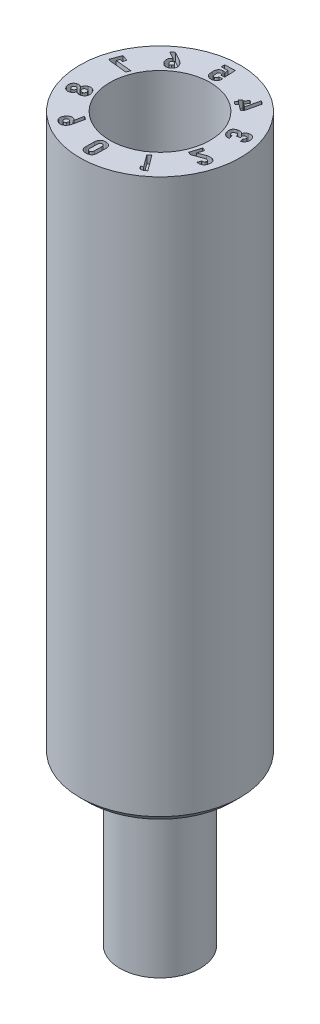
SolidWorks part; units mm, degrees
other "<M2L6-SetScrew>-<Chamfer1>" parameters "D10"=0.19
ref_plane "Front Plane" through (0, 0, 0) normal (0, 0, 1) x (1, 0, 0)
ref_plane "Top Plane" through (0, 0, 0) normal (0, 1, 0) x (1, 0, 0)
ref_plane "Right Plane" through (0, 0, 0) normal (1, 0, 0) x (0, 0, -1)
sketch "Sketch1" plane through (0, 0, 0) normal (0, 0, 1) x (1, 0, 0)
  line L0 (0, 0) -> (0, 20) construction
  line L1 (0, -55) -> (0, 55) construction
  line L2 (1, -14) -> (1.81, -14)
  line L4 (2, -13.81) -> (2, 0)
  line L5 (2, 0) -> (1.25, 0)
  line L6 (1.25, 0) -> (1.25, -2.3)
  line L7 (1.25, -2.3) -> (0.7, -2.3)
  line L8 (0.7, -2.3) -> (0.7, -10.5)
  line L9 (0.7, -10.5) -> (1, -10.5)
  line L10 (1, -10.5) -> (1, -14)
  line L11 (1.81, -14) -> (2, -13.81)
  point P6 (2, -14)
  dimension "D1" = 2.3
  dimension "D2" = 3.5
  dimension "D3" = 1.4
  dimension "D4" = 2.5
  dimension "D5" = 4
  dimension "D6" = 2
  dimension "D7" = 14
revolve "Revolve1" add sketch "Sketch1" angle 360 about L0
sketch "Sketch2" plane through (0, 0, 0) normal (0, 1, 0) x (1, 0, 0)
  line L0 (0, 0) -> (0, 2.1482) construction
  line L1 (0, 0) -> (1.2627, 1.738) construction
  line L2 (0, 0) -> (2.0431, 0.6638) construction
  line L3 (0, 0) -> (2.0431, -0.6638) construction
  line L4 (0, 0) -> (1.2627, -1.738) construction
  line L5 (0, 0) -> (0, -2.1482) construction
  line L6 (0, 0) -> (-1.2627, -1.738) construction
  line L7 (0, 0) -> (-2.0431, -0.6638) construction
  line L8 (0, 0) -> (-2.0431, 0.6638) construction
  line L9 (0, 0) -> (-1.2627, 1.738) construction
  line L10 (1.4479, 0.2841) -> (1.4204, 0.3732)
  line L11 (1.3976, 0.475) -> (1.4083, 0.4783)
  line L12 (1.4758, 0.4533) -> (1.4877, 0.4146)
  line L13 (1.4877, 0.4146) -> (1.5707, 0.4402)
  line L14 (1.5707, 0.4402) -> (1.5588, 0.479)
  line L15 (1.5955, 0.5278) -> (1.6034, 0.5303)
  line L16 (1.6228, 0.4435) -> (1.6502, 0.3548)
  line L17 (1.5836, 0.6255) -> (1.5698, 0.6212)
  line L18 (1.3732, 0.5689) -> (1.3593, 0.5647)
  line L19 (1.0367, 1.0854) -> (1.1167, 1.4309)
  line L20 (1.1167, 1.4309) -> (1.0358, 1.4934)
  line L21 (1.0358, 1.4934) -> (0.955, 1.1535)
  line L22 (0.955, 1.1535) -> (0.8859, 1.2068)
  line L23 (0.7846, 1.285) -> (0.7314, 1.2159)
  line L24 (0.7314, 1.2159) -> (0.7611, 1.193)
  line L25 (0.9859, 1.0195) -> (1.0367, 1.0854)
  line L26 (0.96, 1.3028) -> (0.8884, 1.358)
  line L27 (0.8884, 1.358) -> (0.8143, 1.262)
  line L28 (0.716, 1.1345) -> (0.7875, 1.0793)
  line L29 (0.7875, 1.0793) -> (0.8326, 1.1378)
  line L30 (0.0809, 1.4808) -> (0.0808, 1.4811)
  line L31 (0.0808, 1.4811) -> (-0.0096, 1.4773)
  line L32 (-0.0096, 1.4773) -> (-0.0096, 1.4771)
  line L33 (-0.1111, 1.4766) -> (-0.1127, 1.5168)
  line L34 (-0.0169, 1.5422) -> (0.0676, 1.5456)
  line L35 (0.0676, 1.5456) -> (0.0564, 1.8216)
  line L36 (0.0564, 1.8216) -> (-0.2014, 1.8111)
  line L37 (-0.2014, 1.8111) -> (-0.1979, 1.7239)
  line L38 (-0.1979, 1.7239) -> (-0.0305, 1.7307)
  line L39 (-0.0305, 1.7307) -> (-0.027, 1.6459)
  line L40 (-0.2031, 1.5131) -> (-0.2014, 1.4729)
  line L41 (-0.7763, 1.268) -> (-0.7764, 1.2683)
  line L42 (-0.8824, 1.3564) -> (-1.0842, 1.4662)
  line L43 (-1.0842, 1.4662) -> (-1.1671, 1.4055)
  line L44 (-1.1671, 1.4055) -> (-0.9736, 1.3024)
  line L46 (-1.0054, 1.1028) -> (-1.0051, 1.1026)
  line L47 (-0.9283, 1.1518) -> (-0.9285, 1.152)
  line L48 (-0.8472, 1.2111) -> (-0.8471, 1.2109)
  line L49 (-1.7044, 0.4666) -> (-1.2744, 0.4221)
  line L50 (-1.2744, 0.4221) -> (-1.2404, 0.5138)
  line L51 (-1.2404, 0.5138) -> (-1.6439, 0.5521)
  line L52 (-1.6439, 0.5521) -> (-1.6153, 0.6293)
  line L53 (-1.6153, 0.6293) -> (-1.5477, 0.6043)
  line L54 (-1.5477, 0.6043) -> (-1.5165, 0.6889)
  line L55 (-1.5165, 0.6889) -> (-1.6657, 0.744)
  line L56 (-1.6657, 0.744) -> (-1.7605, 0.4874)
  line L57 (-1.7605, 0.4874) -> (-1.7044, 0.4666)
  line L58 (-1.4291, -0.351) -> (-1.4365, -0.3538)
  line L59 (-1.629, -0.4367) -> (-1.6407, -0.4411)
  line L60 (-1.5409, -0.7068) -> (-1.5292, -0.7024)
  line L61 (-1.3298, -0.6378) -> (-1.3224, -0.635)
  line L62 (-1.3664, -0.5552) -> (-1.3707, -0.5569)
  line L63 (-1.4138, -0.4416) -> (-1.4092, -0.4398)
  line L64 (-1.5576, -0.6166) -> (-1.5619, -0.6182)
  line L65 (-1.5979, -0.5214) -> (-1.5932, -0.5196)
  line L67 (-1.0829, -1.2873) -> (-1.0831, -1.2876)
  line L68 (-0.8502, -1.446) -> (-0.8501, -1.4459)
  line L69 (-0.8037, -1.319) -> (-0.7576, -1.1005)
  line L70 (-0.7576, -1.1005) -> (-0.8365, -1.046)
  line L71 (-0.8365, -1.046) -> (-0.8784, -1.2623)
  line L72 (-0.9271, -1.3978) -> (-0.9273, -1.3982)
  line L73 (-1.0097, -1.3409) -> (-1.0095, -1.3406)
  line L74 (-0.1607, -1.4672) -> (-0.1651, -1.6853)
  line L75 (0.122, -1.6911) -> (0.1264, -1.4729)
  line L76 (0.0355, -1.4943) -> (0.032, -1.6662)
  line L77 (-0.0742, -1.6641) -> (-0.0707, -1.4921)
  line L78 (0.8456, -1.048) -> (0.7727, -1.1016)
  line L79 (0.7727, -1.1016) -> (0.9946, -1.4028)
  line L80 (0.9946, -1.4028) -> (0.9342, -1.4196)
  line L81 (0.9342, -1.4196) -> (0.9913, -1.4971)
  line L82 (0.9913, -1.4971) -> (1.0682, -1.4807)
  line L83 (1.0682, -1.4807) -> (1.1305, -1.4348)
  line L84 (1.1305, -1.4348) -> (0.8456, -1.048)
  line L85 (1.3151, -0.5535) -> (1.5704, -0.4606)
  line L86 (1.6329, -0.4556) -> (1.6336, -0.4558)
  line L87 (1.5885, -0.5477) -> (1.5882, -0.5476)
  line L88 (1.5882, -0.5476) -> (1.5607, -0.6361)
  line L89 (1.5607, -0.6361) -> (1.561, -0.6361)
  line L90 (1.6637, -0.3678) -> (1.6634, -0.3677)
  line L91 (1.5332, -0.3725) -> (1.356, -0.441)
  line L92 (1.356, -0.441) -> (1.4045, -0.2845)
  line L93 (1.4045, -0.2845) -> (1.3214, -0.2587)
  line L94 (1.3214, -0.2587) -> (1.2373, -0.5294)
  line L95 (1.2373, -0.5294) -> (1.3151, -0.5535)
  line L96 (0.8143, 1.262) -> (0.7846, 1.285)
  line L97 (0.8859, 1.2068) -> (0.96, 1.3028)
  line L98 (0.7611, 1.193) -> (0.716, 1.1345)
  line L99 (0.8326, 1.1378) -> (0.9859, 1.0195)
  circle A0 centre (0, 0) radius 1.35 construction
  spline S0 degree 3 poles (1.2746, 0.3913) (1.2786, 0.3781) (1.2864, 0.3593) (1.3002, 0.3366) (1.3121, 0.3218) (1.3252, 0.309) (1.3398, 0.2983) (1.3555, 0.2897) (1.3724, 0.2835) (1.3902, 0.2796) (1.4157, 0.278) (1.4351, 0.2809) (1.4479, 0.2841) knots 0 0 0 0 0.181683 0.266779 0.349462 0.430127 0.508479 0.586246 0.664753 0.744624 0.826298 1 1 1 1
  spline S1 degree 3 poles (1.4204, 0.3732) (1.4158, 0.3725) (1.4089, 0.3717) (1.4, 0.3727) (1.3937, 0.374) (1.388, 0.376) (1.3827, 0.3787) (1.3778, 0.382) (1.3735, 0.386) (1.3695, 0.3905) (1.3651, 0.3976) (1.3623, 0.4034) (1.3612, 0.4077) knots 0 0 0 0 0.185457 0.27165 0.355725 0.436094 0.513024 0.590764 0.667857 0.745908 0.82735 1 1 1 1
  spline S2 degree 3 poles (1.3612, 0.4077) (1.359, 0.415) (1.3568, 0.4262) (1.3591, 0.4406) (1.3628, 0.45) (1.3687, 0.4583) (1.3797, 0.4681) (1.3902, 0.4727) (1.3976, 0.475) knots 0 0 0 0 0.265932 0.383608 0.497715 0.612962 0.730917 1 1 1 1
  spline S3 degree 3 poles (1.4083, 0.4783) (1.4161, 0.4806) (1.4276, 0.4833) (1.4425, 0.4827) (1.4519, 0.4804) (1.4602, 0.4763) (1.4696, 0.468) (1.4739, 0.4594) (1.4758, 0.4533) knots 0 0 0 0 0.299669 0.427494 0.54492 0.656239 0.76551 1 1 1 1
  spline S4 degree 3 poles (1.5588, 0.479) (1.5572, 0.4839) (1.5562, 0.4918) (1.5592, 0.5018) (1.5633, 0.5085) (1.5691, 0.5145) (1.5795, 0.522) (1.5888, 0.5257) (1.5955, 0.5278) knots 0 0 0 0 0.227157 0.335145 0.446307 0.566888 0.696159 1 1 1 1
  spline S5 degree 3 poles (1.6034, 0.5303) (1.6097, 0.5322) (1.619, 0.5341) (1.6312, 0.5331) (1.639, 0.5307) (1.6458, 0.5267) (1.6538, 0.5192) (1.6572, 0.5114) (1.659, 0.5061) knots 0 0 0 0 0.287271 0.410582 0.526995 0.640263 0.752437 1 1 1 1
  spline S6 degree 3 poles (1.659, 0.5061) (1.6601, 0.5023) (1.6613, 0.4965) (1.6607, 0.4887) (1.6597, 0.483) (1.6578, 0.4773) (1.6551, 0.4718) (1.6516, 0.4664) (1.6473, 0.4613) (1.6423, 0.4563) (1.6343, 0.45) (1.6275, 0.446) (1.6228, 0.4435) knots 0 0 0 0 0.148889 0.222249 0.295849 0.370946 0.4481 0.528643 0.613746 0.703186 0.796416 1 1 1 1
  spline S7 degree 3 poles (1.6502, 0.3548) (1.663, 0.36) (1.6812, 0.3694) (1.7022, 0.3858) (1.7156, 0.3992) (1.7269, 0.4137) (1.7359, 0.4292) (1.7425, 0.4456) (1.747, 0.4627) (1.7491, 0.4805) (1.7491, 0.5049) (1.7454, 0.5232) (1.7417, 0.5351) knots 0 0 0 0 0.185416 0.271962 0.355878 0.437532 0.516928 0.594953 0.673773 0.753208 0.833291 1 1 1 1
  spline S8 degree 3 poles (1.7417, 0.5351) (1.7387, 0.5446) (1.7336, 0.5584) (1.7247, 0.5753) (1.7177, 0.5865) (1.7098, 0.5965) (1.7012, 0.6054) (1.6919, 0.6131) (1.6819, 0.6196) (1.6713, 0.6249) (1.6602, 0.6289) (1.6486, 0.6316) (1.6365, 0.633) (1.6239, 0.633) (1.606, 0.6315) (1.5926, 0.6283) (1.5836, 0.6255) knots 0 0 0 0 0.145055 0.212046 0.275805 0.336852 0.396305 0.454277 0.511617 0.568475 0.624946 0.682076 0.740297 0.801057 0.86383 1 1 1 1
  spline S9 degree 3 poles (1.5698, 0.6212) (1.5598, 0.6181) (1.5454, 0.6118) (1.5292, 0.5993) (1.519, 0.5884) (1.5106, 0.576) (1.502, 0.5574) (1.4987, 0.5422) (1.4981, 0.5317) knots 0 0 0 0 0.257419 0.379084 0.500244 0.621467 0.743289 1 1 1 1
  spline S10 degree 3 poles (1.4981, 0.5317) (1.4952, 0.5367) (1.4903, 0.5436) (1.4829, 0.5519) (1.4767, 0.5572) (1.4701, 0.562) (1.4631, 0.5662) (1.4556, 0.5695) (1.4477, 0.5723) (1.4394, 0.5744) (1.4307, 0.5757) (1.4218, 0.5765) (1.4126, 0.5763) (1.4031, 0.5756) (1.3898, 0.5736) (1.3799, 0.571) (1.3732, 0.5689) knots 0 0 0 0 0.120763 0.17857 0.235582 0.292707 0.349757 0.40792 0.467064 0.527112 0.588557 0.651317 0.715936 0.782624 0.852298 1 1 1 1
  spline S11 degree 3 poles (1.3593, 0.5647) (1.3469, 0.5608) (1.3292, 0.5536) (1.3086, 0.5398) (1.2956, 0.5283) (1.2849, 0.5153) (1.2765, 0.5009) (1.2702, 0.4853) (1.2664, 0.4684) (1.2648, 0.4505) (1.266, 0.4243) (1.2706, 0.4045) (1.2746, 0.3913) knots 0 0 0 0 0.177867 0.259463 0.33772 0.413912 0.488903 0.56471 0.642963 0.724718 0.810831 1 1 1 1
  spline S12 degree 3 poles (-0.0539, 1.3313) (-0.0416, 1.3319) (-0.0233, 1.3344) (-0.0006, 1.3428) (0.0151, 1.3508) (0.0294, 1.3609) (0.0423, 1.373) (0.0534, 1.387) (0.063, 1.4027) (0.0705, 1.4202) (0.0783, 1.4461) (0.0804, 1.4667) (0.0809, 1.4808) knots 0 0 0 0 0.165248 0.244428 0.322868 0.40092 0.478537 0.557561 0.639431 0.724158 0.811751 1 1 1 1
  spline S13 degree 3 poles (-0.0096, 1.4771) (-0.0101, 1.469) (-0.012, 1.4574) (-0.018, 1.4436) (-0.0238, 1.4351) (-0.0308, 1.4282) (-0.0422, 1.4215) (-0.052, 1.4192) (-0.0588, 1.4191) knots 0 0 0 0 0.286743 0.413342 0.532867 0.64823 0.760761 1 1 1 1
  spline S14 degree 3 poles (-0.0588, 1.4191) (-0.0659, 1.4188) (-0.0766, 1.42) (-0.089, 1.4264) (-0.0966, 1.433) (-0.1028, 1.4415) (-0.109, 1.4559) (-0.1107, 1.4681) (-0.1111, 1.4766) knots 0 0 0 0 0.245031 0.356291 0.468606 0.58576 0.710463 1 1 1 1
  spline S15 degree 3 poles (-0.1127, 1.5168) (-0.113, 1.5252) (-0.1126, 1.5374) (-0.108, 1.5522) (-0.1032, 1.5611) (-0.0969, 1.5682) (-0.0866, 1.5756) (-0.0769, 1.5773) (-0.0706, 1.5777) knots 0 0 0 0 0.303265 0.432107 0.550999 0.662525 0.769301 1 1 1 1
  spline S16 degree 3 poles (-0.0706, 1.5777) (-0.0645, 1.578) (-0.0555, 1.5772) (-0.0444, 1.5734) (-0.0369, 1.5694) (-0.0303, 1.5641) (-0.0226, 1.5556) (-0.0188, 1.5477) (-0.0169, 1.5422) knots 0 0 0 0 0.262806 0.385849 0.507006 0.626637 0.74726 1 1 1 1
  spline S17 degree 3 poles (-0.027, 1.6459) (-0.0308, 1.6493) (-0.0374, 1.6534) (-0.0472, 1.6579) (-0.064, 1.6631) (-0.0789, 1.6654) (-0.0909, 1.6648) knots 0 0 0 0 0.220773 0.342538 0.473516 1 1 1 1
  spline S18 degree 3 poles (-0.0909, 1.6648) (-0.1025, 1.6644) (-0.1197, 1.6618) (-0.1406, 1.6535) (-0.1544, 1.6454) (-0.1666, 1.6352) (-0.1771, 1.623) (-0.186, 1.6089) (-0.193, 1.5929) (-0.1983, 1.5753) (-0.2032, 1.5486) (-0.2037, 1.5275) (-0.2031, 1.5131) knots 0 0 0 0 0.163697 0.239777 0.314014 0.387849 0.46222 0.538949 0.620185 0.706202 0.797161 1 1 1 1
  spline S19 degree 3 poles (-0.2014, 1.4729) (-0.2008, 1.4584) (-0.1984, 1.4373) (-0.19, 1.4112) (-0.1821, 1.3939) (-0.1721, 1.3787) (-0.1604, 1.3653) (-0.1467, 1.3542) (-0.1313, 1.345) (-0.1142, 1.3381) (-0.0884, 1.3317) (-0.0679, 1.3308) (-0.0539, 1.3313) knots 0 0 0 0 0.186996 0.272151 0.353392 0.430995 0.506763 0.582082 0.658466 0.737154 0.819418 1 1 1 1
  spline S20 degree 3 poles (-0.804, 1.0672) (-0.7928, 1.0753) (-0.7776, 1.0888) (-0.7614, 1.1096) (-0.7523, 1.1256) (-0.7458, 1.1422) (-0.7421, 1.1594) (-0.741, 1.177) (-0.7427, 1.1949) (-0.7471, 1.2132) (-0.7568, 1.2385) (-0.7677, 1.2565) (-0.7763, 1.268) knots 0 0 0 0 0.180366 0.262884 0.342255 0.418951 0.494245 0.569512 0.647459 0.728424 0.812968 1 1 1 1
  spline S21 degree 3 poles (-0.7764, 1.2683) (-0.7817, 1.2756) (-0.7906, 1.2861) (-0.8037, 1.2995) (-0.8258, 1.3199) (-0.8465, 1.3349) (-0.8639, 1.3457) knots 0 0 0 0 0.230224 0.351718 0.476396 1 1 1 1
  spline S22 degree 3 poles (-0.8639, 1.3457) (-0.867, 1.3476) (-0.873, 1.3515) (-0.8793, 1.3547) (-0.8824, 1.3564) knots 0 0 0 0 0.503278 1 1 1 1
  spline S23 degree 3 poles (-0.9736, 1.3024) (-0.979, 1.2999) (-0.9841, 1.2967) (-0.9889, 1.2933) knots 0.757694 0.757694 0.757694 0.757694 1 1 1 1
  spline S24 degree 3 poles (-0.9889, 1.2933) (-0.9988, 1.2859) (-1.0127, 1.2738) (-1.0264, 1.2545) (-1.0342, 1.2397) (-1.0393, 1.2241) (-1.0421, 1.2079) (-1.0422, 1.1912) (-1.0397, 1.174) (-1.0348, 1.1564) (-1.0247, 1.1317) (-1.0137, 1.1142) (-1.0054, 1.1028) knots 0 0 0 0 0.171941 0.250754 0.327022 0.401875 0.476719 0.55304 0.632515 0.716061 0.804595 1 1 1 1
  spline S25 degree 3 poles (-1.0051, 1.1026) (-0.9965, 1.091) (-0.9828, 1.0747) (-0.9613, 1.0578) (-0.9451, 1.0479) (-0.9283, 1.0406) (-0.9111, 1.036) (-0.8935, 1.0344) (-0.8756, 1.0355) (-0.8576, 1.0393) (-0.8328, 1.0483) (-0.8153, 1.059) (-0.804, 1.0672) knots 0 0 0 0 0.18693 0.27199 0.353558 0.431698 0.507578 0.582621 0.659126 0.737927 0.819687 1 1 1 1
  spline S26 degree 3 poles (-0.8557, 1.1378) (-0.8615, 1.1335) (-0.871, 1.1284) (-0.8846, 1.1262) (-0.8943, 1.1269) (-0.9037, 1.1299) (-0.9161, 1.1373) (-0.9237, 1.1456) (-0.9283, 1.1518) knots 0 0 0 0 0.259246 0.374992 0.488134 0.603533 0.723662 1 1 1 1
  spline S27 degree 3 poles (-0.9285, 1.152) (-0.9337, 1.1592) (-0.9405, 1.1702) (-0.9447, 1.186) (-0.9456, 1.1967) (-0.9439, 1.2069) (-0.9382, 1.2198) (-0.9305, 1.2276) (-0.9246, 1.2319) knots 0 0 0 0 0.294433 0.420251 0.537313 0.648118 0.757983 1 1 1 1
  spline S28 degree 3 poles (-0.9246, 1.2319) (-0.9188, 1.2362) (-0.909, 1.2411) (-0.8949, 1.2424) (-0.8846, 1.2408) (-0.8745, 1.2368) (-0.861, 1.2278) (-0.8524, 1.2182) (-0.8472, 1.2111) knots 0 0 0 0 0.239826 0.351215 0.463359 0.581448 0.707724 1 1 1 1
  spline S29 degree 3 poles (-0.8471, 1.2109) (-0.8424, 1.2047) (-0.837, 1.1948) (-0.8336, 1.1808) (-0.8336, 1.1709) (-0.8359, 1.1616) (-0.8422, 1.1494) (-0.8499, 1.142) (-0.8557, 1.1378) knots 0 0 0 0 0.277781 0.398101 0.513519 0.626975 0.74112 1 1 1 1
  spline S30 degree 3 poles (-1.2513, -0.4462) (-1.2564, -0.4329) (-1.2654, -0.4138) (-1.2814, -0.3915) (-1.2944, -0.3772) (-1.3085, -0.3651) (-1.3238, -0.3555) (-1.3399, -0.3482) (-1.357, -0.3435) (-1.3747, -0.3413) (-1.3992, -0.342) (-1.4173, -0.3467) (-1.4291, -0.351) knots 0 0 0 0 0.189175 0.276812 0.361818 0.443704 0.522314 0.599383 0.676963 0.754972 0.833568 1 1 1 1
  spline S31 degree 3 poles (-1.4365, -0.3538) (-1.4476, -0.3578) (-1.4632, -0.3665) (-1.4812, -0.3821) (-1.4931, -0.3958) (-1.5033, -0.4109) (-1.5135, -0.4327) (-1.5179, -0.4503) (-1.5189, -0.4622) knots 0 0 0 0 0.246485 0.370096 0.497478 0.625315 0.749907 1 1 1 1
  spline S32 degree 3 poles (-1.5189, -0.4622) (-1.5263, -0.4551) (-1.5388, -0.4462) (-1.5572, -0.4375) (-1.5717, -0.4332) (-1.5865, -0.4308) (-1.6059, -0.4303) (-1.6201, -0.4333) (-1.629, -0.4367) knots 0 0 0 0 0.257183 0.384027 0.511932 0.638293 0.759553 1 1 1 1
  spline S33 degree 3 poles (-1.6407, -0.4411) (-1.6519, -0.4452) (-1.6676, -0.4533) (-1.6854, -0.468) (-1.6966, -0.4805) (-1.7059, -0.4944) (-1.7129, -0.5095) (-1.7179, -0.5257) (-1.7205, -0.543) (-1.7211, -0.5611) (-1.7184, -0.5866) (-1.7133, -0.6057) (-1.7085, -0.6182) knots 0 0 0 0 0.166984 0.245851 0.324253 0.401991 0.479307 0.558026 0.639856 0.724356 0.811977 1 1 1 1
  spline S34 degree 3 poles (-1.7085, -0.6182) (-1.7038, -0.6307) (-1.6954, -0.6485) (-1.6803, -0.6693) (-1.6681, -0.6826) (-1.6546, -0.6938) (-1.6403, -0.7028) (-1.625, -0.7095) (-1.6089, -0.7139) (-1.5923, -0.7159) (-1.5692, -0.7153) (-1.552, -0.7109) (-1.5409, -0.7068) knots 0 0 0 0 0.188197 0.275504 0.360063 0.441844 0.520761 0.598109 0.675754 0.753946 0.833047 1 1 1 1
  spline S35 degree 3 poles (-1.5292, -0.7024) (-1.5201, -0.699) (-1.5074, -0.6917) (-1.4928, -0.6785) (-1.4835, -0.6667) (-1.4756, -0.6537) (-1.4674, -0.635) (-1.4641, -0.62) (-1.4633, -0.6097) knots 0 0 0 0 0.241993 0.363852 0.489908 0.618019 0.743662 1 1 1 1
  spline S36 degree 3 poles (-1.4633, -0.6097) (-1.4545, -0.618) (-1.4397, -0.6286) (-1.4175, -0.6383) (-1.3999, -0.6432) (-1.382, -0.6458) (-1.3582, -0.6459) (-1.3408, -0.6419) (-1.3298, -0.6378) knots 0 0 0 0 0.251821 0.377293 0.504427 0.631172 0.754543 1 1 1 1
  spline S37 degree 3 poles (-1.3224, -0.635) (-1.3107, -0.6305) (-1.2938, -0.6222) (-1.275, -0.6064) (-1.2632, -0.5932) (-1.2535, -0.5784) (-1.246, -0.5623) (-1.241, -0.545) (-1.2382, -0.5265) (-1.2378, -0.5072) (-1.2404, -0.4799) (-1.2463, -0.4596) (-1.2513, -0.4462) knots 0 0 0 0 0.166594 0.244996 0.323038 0.400282 0.477731 0.556466 0.638207 0.723428 0.810999 1 1 1 1
  spline S38 degree 3 poles (-1.3327, -0.4768) (-1.3305, -0.4822) (-1.3285, -0.4904) (-1.3277, -0.5015) (-1.3282, -0.5094) (-1.3296, -0.5171) (-1.3321, -0.5243) (-1.3356, -0.5311) (-1.3401, -0.5373) (-1.3455, -0.5429) (-1.3539, -0.5496) (-1.3612, -0.5533) (-1.3664, -0.5552) knots 0 0 0 0 0.179272 0.264187 0.346475 0.427592 0.506858 0.584554 0.664728 0.745966 0.827587 1 1 1 1
  spline S39 degree 3 poles (-1.3707, -0.5569) (-1.3754, -0.5587) (-1.3828, -0.5605) (-1.3928, -0.5608) (-1.4, -0.5598) (-1.4069, -0.5578) (-1.4135, -0.555) (-1.4196, -0.5509) (-1.4255, -0.5462) (-1.4308, -0.5404) (-1.4372, -0.5315) (-1.4409, -0.5238) (-1.443, -0.5183) knots 0 0 0 0 0.165829 0.245352 0.323578 0.401428 0.478915 0.558246 0.639546 0.723687 0.811011 1 1 1 1
  spline S40 degree 3 poles (-1.443, -0.5183) (-1.4449, -0.5129) (-1.4473, -0.5047) (-1.4484, -0.4937) (-1.4482, -0.4858) (-1.4469, -0.4784) (-1.4449, -0.4713) (-1.4418, -0.4647) (-1.4378, -0.4587) (-1.4331, -0.4532) (-1.4253, -0.4469) (-1.4186, -0.4433) (-1.4138, -0.4416) knots 0 0 0 0 0.187551 0.275436 0.359581 0.441432 0.520795 0.598529 0.676292 0.754694 0.834178 1 1 1 1
  spline S41 degree 3 poles (-1.4092, -0.4398) (-1.404, -0.4378) (-1.396, -0.4359) (-1.3853, -0.4353) (-1.3777, -0.4361) (-1.3702, -0.4379) (-1.3632, -0.4407) (-1.3566, -0.4445) (-1.3506, -0.4493) (-1.3451, -0.455) (-1.3383, -0.4638) (-1.3346, -0.4715) (-1.3327, -0.4768) knots 0 0 0 0 0.173917 0.254381 0.335455 0.415101 0.493454 0.572173 0.652898 0.736127 0.820128 1 1 1 1
  spline S42 degree 3 poles (-1.5249, -0.5492) (-1.5232, -0.5537) (-1.5213, -0.5607) (-1.5208, -0.5702) (-1.5215, -0.5769) (-1.5231, -0.5834) (-1.5254, -0.5896) (-1.5289, -0.5953) (-1.5331, -0.6007) (-1.5381, -0.6055) (-1.546, -0.6114) (-1.5528, -0.6149) (-1.5576, -0.6166) knots 0 0 0 0 0.172987 0.255041 0.33535 0.413926 0.491261 0.570075 0.650776 0.733352 0.818024 1 1 1 1
  spline S43 degree 3 poles (-1.5619, -0.6182) (-1.5663, -0.6199) (-1.5732, -0.6217) (-1.5824, -0.6222) (-1.5889, -0.6217) (-1.5952, -0.6202) (-1.6012, -0.618) (-1.6068, -0.6149) (-1.6119, -0.6109) (-1.6166, -0.6061) (-1.6223, -0.5987) (-1.6253, -0.5921) (-1.6272, -0.5876) knots 0 0 0 0 0.17595 0.259533 0.339598 0.418606 0.49628 0.574103 0.65444 0.736649 0.81978 1 1 1 1
  spline S44 degree 3 poles (-1.6272, -0.5876) (-1.6287, -0.583) (-1.6309, -0.5761) (-1.6314, -0.5666) (-1.6311, -0.56) (-1.6297, -0.5536) (-1.6276, -0.5475) (-1.6246, -0.5419) (-1.6208, -0.5366) (-1.6161, -0.5319) (-1.6087, -0.5262) (-1.6023, -0.5231) (-1.5979, -0.5214) knots 0 0 0 0 0.17984 0.263994 0.345424 0.425538 0.502413 0.580318 0.659684 0.740423 0.824355 1 1 1 1
  spline S45 degree 3 poles (-1.5932, -0.5196) (-1.5886, -0.5178) (-1.5814, -0.5161) (-1.5717, -0.5152) (-1.5648, -0.5156) (-1.5582, -0.5169) (-1.5519, -0.5191) (-1.546, -0.5221) (-1.5407, -0.526) (-1.5357, -0.5306) (-1.5298, -0.5381) (-1.5266, -0.5446) (-1.5249, -0.5492) knots 0 0 0 0 0.179531 0.263436 0.346081 0.426526 0.504641 0.583615 0.662077 0.742183 0.825108 1 1 1 1
  spline S46 degree 3 poles (-0.8784, -1.2623) (-0.8786, -1.262) (-0.8809, -1.2591) (-0.8883, -1.2511) (-0.8964, -1.2445) (-0.9023, -1.2405) knots 0.56455 0.56455 0.56455 0.56455 0.581137 0.712767 1 1 1 1
  spline S47 degree 3 poles (-0.9023, -1.2405) (-0.9118, -1.2341) (-0.927, -1.2259) (-0.9487, -1.2201) (-0.965, -1.2183) (-0.9813, -1.2187) (-0.9974, -1.2218) (-1.0133, -1.2271) (-1.0287, -1.2349) (-1.0436, -1.2448) (-1.0629, -1.2613) (-1.0753, -1.2764) (-1.0829, -1.2873) knots 0 0 0 0 0.164718 0.243421 0.320876 0.398529 0.475887 0.554764 0.637143 0.722497 0.810293 1 1 1 1
  spline S48 degree 3 poles (-1.0831, -1.2876) (-1.0912, -1.2995) (-1.1019, -1.3179) (-1.111, -1.3438) (-1.115, -1.3623) (-1.1164, -1.3805) (-1.1149, -1.3982) (-1.1107, -1.4153) (-1.1039, -1.4318) (-1.0944, -1.4475) (-1.0777, -1.4679) (-1.0621, -1.481) (-1.0506, -1.4888) knots 0 0 0 0 0.187658 0.273036 0.354626 0.43256 0.508323 0.583346 0.659472 0.738045 0.82031 1 1 1 1
  spline S49 degree 3 poles (-1.0506, -1.4888) (-1.0393, -1.4968) (-1.0214, -1.5064) (-0.9965, -1.5148) (-0.9783, -1.518) (-0.9604, -1.5184) (-0.9428, -1.516) (-0.9256, -1.511) (-0.909, -1.5032) (-0.893, -1.4926) (-0.872, -1.4746) (-0.8585, -1.458) (-0.8502, -1.446) knots 0 0 0 0 0.178101 0.25969 0.338284 0.414846 0.490236 0.565933 0.644109 0.726033 0.811851 1 1 1 1
  spline S50 degree 3 poles (-0.8501, -1.4459) (-0.8452, -1.4389) (-0.8389, -1.4277) (-0.8312, -1.4119) (-0.8261, -1.3987) (-0.8211, -1.3848) (-0.8149, -1.3646) (-0.8104, -1.3489) (-0.808, -1.3381) knots 0 0 0 0 0.21721 0.332572 0.453609 0.580474 0.714019 1 1 1 1
  spline S51 degree 3 poles (-0.808, -1.3381) (-0.8072, -1.3349) (-0.8057, -1.3286) (-0.8041, -1.3223) (-0.8037, -1.319) knots 0 0 0 0 0.500805 1 1 1 1
  spline S52 degree 3 poles (-0.9349, -1.321) (-0.9289, -1.3249) (-0.9212, -1.3324) (-0.9149, -1.3449) (-0.9129, -1.3548) (-0.913, -1.3652) (-0.9164, -1.3803) (-0.9224, -1.3909) (-0.9271, -1.3978) knots 0 0 0 0 0.246489 0.359075 0.472631 0.589865 0.712601 1 1 1 1
  spline S53 degree 3 poles (-0.9273, -1.3982) (-0.9319, -1.4049) (-0.9396, -1.4138) (-0.9521, -1.4221) (-0.9617, -1.4255) (-0.9715, -1.4269) (-0.9852, -1.4251) (-0.9948, -1.4206) (-1.0007, -1.4164) knots 0 0 0 0 0.282845 0.406116 0.522377 0.635244 0.748913 1 1 1 1
  spline S54 degree 3 poles (-1.0007, -1.4164) (-1.0066, -1.4123) (-1.0146, -1.405) (-1.0209, -1.3926) (-1.0231, -1.383) (-1.0231, -1.3728) (-1.02, -1.358) (-1.0142, -1.3476) (-1.0097, -1.3409) knots 0 0 0 0 0.252097 0.365471 0.478299 0.594478 0.716992 1 1 1 1
  spline S55 degree 3 poles (-1.0095, -1.3406) (-1.0047, -1.3338) (-0.9969, -1.3243) (-0.984, -1.3158) (-0.9744, -1.312) (-0.9644, -1.3106) (-0.9506, -1.3121) (-0.9408, -1.3168) (-0.9349, -1.321) knots 0 0 0 0 0.287279 0.410558 0.526824 0.639438 0.751401 1 1 1 1
  spline S56 degree 3 poles (-0.0144, -1.3337) (-0.0255, -1.3336) (-0.0416, -1.3341) (-0.0623, -1.3376) (-0.0764, -1.3411) (-0.0893, -1.3461) (-0.1013, -1.352) (-0.1123, -1.3592) (-0.1222, -1.3676) (-0.131, -1.3769) (-0.1387, -1.3872) (-0.1454, -1.3983) (-0.1506, -1.4104) (-0.1549, -1.4233) (-0.1593, -1.4422) (-0.1604, -1.4571) (-0.1607, -1.4672) knots 0 0 0 0 0.147094 0.214667 0.278683 0.340003 0.398815 0.456586 0.513775 0.570607 0.627204 0.684148 0.742495 0.802473 0.86545 1 1 1 1
  spline S57 degree 3 poles (-0.1651, -1.6853) (-0.1652, -1.6955) (-0.1647, -1.7106) (-0.161, -1.7298) (-0.1573, -1.743) (-0.1524, -1.7552) (-0.1463, -1.7667) (-0.139, -1.7772) (-0.1305, -1.7868) (-0.121, -1.7955) (-0.1102, -1.8029) (-0.0985, -1.8094) (-0.0856, -1.8146) (-0.0718, -1.8189) (-0.0513, -1.823) (-0.0353, -1.8243) (-0.0243, -1.8246) knots 0 0 0 0 0.135747 0.199103 0.25945 0.317923 0.374611 0.43142 0.487888 0.54475 0.602235 0.661387 0.722342 0.78643 0.853447 1 1 1 1
  spline S58 degree 3 poles (-0.0243, -1.8246) (-0.0132, -1.8247) (0.003, -1.8241) (0.0237, -1.8208) (0.0377, -1.8172) (0.0507, -1.8125) (0.0627, -1.8065) (0.0737, -1.7995) (0.0836, -1.7913) (0.0924, -1.7821) (0.1001, -1.7719) (0.1066, -1.7607) (0.112, -1.7485) (0.1162, -1.7355) (0.1207, -1.7164) (0.1217, -1.7014) (0.122, -1.6911) knots 0 0 0 0 0.146849 0.21423 0.27814 0.339038 0.398136 0.455568 0.512094 0.568511 0.624662 0.681676 0.739926 0.800218 0.863515 1 1 1 1
  spline S59 degree 3 poles (0.1264, -1.4729) (0.1267, -1.4627) (0.1258, -1.4477) (0.1224, -1.4285) (0.1186, -1.4154) (0.1137, -1.4031) (0.1076, -1.3917) (0.1003, -1.3811) (0.0918, -1.3715) (0.0822, -1.3629) (0.0715, -1.3553) (0.0598, -1.3488) (0.0469, -1.3437) (0.0331, -1.3394) (0.0126, -1.3352) (-0.0034, -1.334) (-0.0144, -1.3337) knots 0 0 0 0 0.135845 0.19871 0.259078 0.317571 0.37487 0.431093 0.487582 0.544792 0.60254 0.661328 0.722709 0.786282 0.853829 1 1 1 1
  spline S60 degree 3 poles (-0.0162, -1.4208) (-0.0119, -1.4209) (-0.0056, -1.4215) (0.0022, -1.4237) (0.0075, -1.4259) (0.0123, -1.4287) (0.0167, -1.4319) (0.0205, -1.4358) (0.0251, -1.4419) (0.0296, -1.4511) (0.0349, -1.4691) (0.0357, -1.4839) (0.0355, -1.4943) knots 0 0 0 0 0.12595 0.18324 0.238647 0.292149 0.344953 0.398378 0.452895 0.567989 0.695611 1 1 1 1
  spline S61 degree 3 poles (0.032, -1.6662) (0.0319, -1.6766) (0.0304, -1.6914) (0.0245, -1.7091) (0.0195, -1.7181) (0.0148, -1.724) (0.0107, -1.7277) (0.0063, -1.7309) (0.0013, -1.7333) (-0.004, -1.7353) (-0.0119, -1.7371) (-0.0182, -1.7375) (-0.0225, -1.7374) knots 0 0 0 0 0.304559 0.432252 0.54741 0.601958 0.654749 0.708143 0.761219 0.816658 0.87398 1 1 1 1
  spline S62 degree 3 poles (-0.0225, -1.7374) (-0.0268, -1.7373) (-0.0331, -1.7367) (-0.0409, -1.7345) (-0.0461, -1.7324) (-0.051, -1.7298) (-0.0552, -1.7263) (-0.0592, -1.7226) (-0.0636, -1.7164) (-0.0683, -1.7073) (-0.0735, -1.6893) (-0.0744, -1.6744) (-0.0742, -1.6641) knots 0 0 0 0 0.12606 0.1834 0.238855 0.291948 0.34459 0.397397 0.451962 0.567613 0.695346 1 1 1 1
  spline S63 degree 3 poles (-0.0707, -1.4921) (-0.0706, -1.4818) (-0.069, -1.467) (-0.0632, -1.4492) (-0.0581, -1.4403) (-0.0533, -1.4343) (-0.0494, -1.4306) (-0.0449, -1.4275) (-0.04, -1.4249) (-0.0347, -1.423) (-0.0267, -1.4211) (-0.0205, -1.4208) (-0.0162, -1.4208) knots 0 0 0 0 0.304487 0.43215 0.547736 0.602271 0.655713 0.707758 0.761276 0.816701 0.87401 1 1 1 1
  spline S64 degree 3 poles (1.5704, -0.4606) (1.5812, -0.4566) (1.5951, -0.4531) (1.6118, -0.4525) (1.6216, -0.4529) (1.6285, -0.4543) (1.6329, -0.4556) knots 0 0 0 0 0.540854 0.666945 0.784018 1 1 1 1
  spline S65 degree 3 poles (1.6336, -0.4558) (1.6392, -0.4576) (1.6471, -0.4613) (1.6549, -0.4695) (1.6589, -0.4766) (1.6613, -0.4847) (1.6622, -0.4974) (1.6602, -0.5072) (1.6581, -0.5138) knots 0 0 0 0 0.246603 0.357207 0.469841 0.586559 0.710115 1 1 1 1
  spline S66 degree 3 poles (1.6581, -0.5138) (1.6561, -0.5203) (1.6516, -0.5297) (1.6418, -0.539) (1.6333, -0.5443) (1.6236, -0.5479) (1.6085, -0.5505) (1.5965, -0.5492) (1.5885, -0.5477) knots 0 0 0 0 0.240714 0.353454 0.46765 0.587016 0.712594 1 1 1 1
  spline S67 degree 3 poles (1.561, -0.6361) (1.5748, -0.6392) (1.5953, -0.6427) (1.6223, -0.6417) (1.641, -0.6389) (1.6586, -0.6336) (1.675, -0.6265) (1.6899, -0.6168) (1.7035, -0.6053) (1.7155, -0.5917) (1.7296, -0.5706) (1.7372, -0.5527) (1.741, -0.5402) knots 0 0 0 0 0.18579 0.271699 0.354267 0.434487 0.512132 0.589438 0.667194 0.746338 0.827015 1 1 1 1
  spline S68 degree 3 poles (1.741, -0.5402) (1.7452, -0.5269) (1.7496, -0.507) (1.7512, -0.4808) (1.7502, -0.4629) (1.7467, -0.4461) (1.7413, -0.4305) (1.7335, -0.4162) (1.7236, -0.4034) (1.7116, -0.3919) (1.6921, -0.3786) (1.6755, -0.3713) (1.6637, -0.3678) knots 0 0 0 0 0.194871 0.282832 0.366282 0.445595 0.521649 0.596272 0.67153 0.748204 0.827532 1 1 1 1
  spline S69 degree 3 poles (1.6634, -0.3677) (1.653, -0.3643) (1.6369, -0.3611) (1.615, -0.359) (1.5982, -0.359) (1.5814, -0.3604) (1.5595, -0.3639) (1.5435, -0.3684) (1.5332, -0.3725) knots 0 0 0 0 0.245827 0.371045 0.497947 0.625415 0.750687 1 1 1 1
  point P17 (0, 0)
  point P18 (0, 0)
  point P21 (0, 0)
  dimension "D1" = 2.7
  dimension "D2" = 10
extrude "Cut-Extrude1" cut sketch "Sketch2" against normal blind 0.2
inserted part "M2L6-SetScrew"
move or copy body "Body-Move/Copy2" placed by mates yes
other "Distance1" parameters "D1"=4
